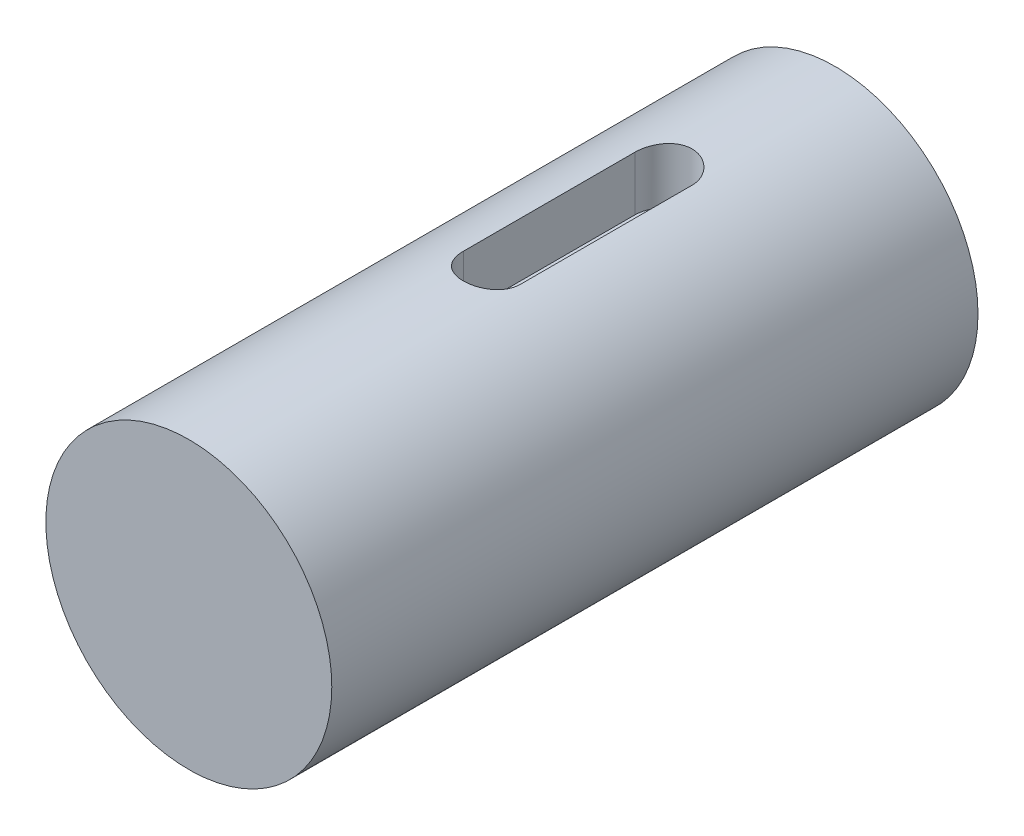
SolidWorks part; units mm, degrees
ref_plane "Ebene vorne" through (0, 0, 0) normal (0, 0, 1) x (1, 0, 0)
ref_plane "Ebene oben" through (0, 0, 0) normal (0, 1, 0) x (1, 0, 0)
ref_plane "Ebene rechts" through (0, 0, 0) normal (1, 0, 0) x (0, 0, -1)
sketch "Skizze1" plane through (0, 0, 0) normal (0, 0, 1) x (1, 0, 0)
  line L0 (0, 0) -> (0, 12.5) construction
  circle A0 centre (0, 0) radius 12.5
  dimension "D1" = 25
extrude "Linear austragen1" add sketch "Skizze1" along normal blind 56.5
ref_plane "Ebene1" through (0, 12.5, 0) normal (0, 1, 0) x (-1, 0, 0)
sketch "Skizze2" plane through (0, 12.5, 0) normal (0, 1, 0) x (-1, 0, 0)
  line L0 (0, 0) -> (0, 31.9579) construction
  line L1 (2.5, 30) -> (2.5, 15)
  line L2 (-2.5, 15) -> (-2.5, 30)
  line L3 (12.5, 0) -> (-12.5, 0) construction
  arc A0 (2.5, 15) -> (-2.5, 15) centre (0, 15) cw
  arc A1 (-2.5, 30) -> (2.5, 30) centre (0, 30) cw
  dimension "D1" = 2.5
  dimension "D2" = 15
  dimension "D3" = 15
extrude "Schnitt-Linear austragen1" cut sketch "Skizze2" against normal blind 5
equation "\"LÄNGE\"=0"
equation "\"BREITE\"=0"
equation "\"HÖHE\"=0"
equation "\"DURCHMESSER\"=0"
equation "\"Stückzahl\"= 1"
